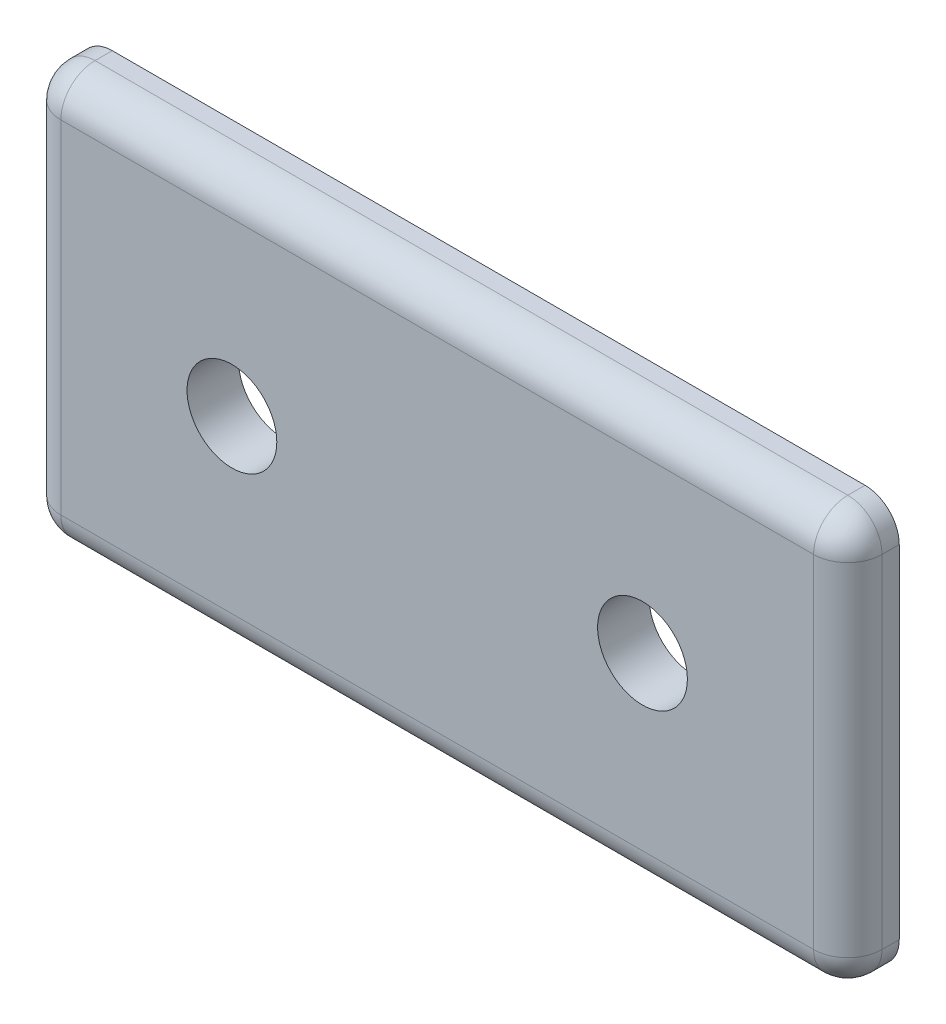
SolidWorks part; units mm, degrees
ref_plane "Front Plane" through (0, 0, 0) normal (0, 0, 1) x (1, 0, 0)
ref_plane "Top Plane" through (0, 0, 0) normal (0, 1, 0) x (1, 0, 0)
ref_plane "Right Plane" through (0, 0, 0) normal (1, 0, 0) x (0, 0, -1)
sketch "Sketch1" plane through (0, 0, 0) normal (0, 0, 1) x (1, 0, 0)
  line L0 (-38.1, 0) -> (38.1, 0) construction
  line L1 (-38.1, 19.05) -> (38.1, 19.05)
  line L2 (-38.1, 19.05) -> (-38.1, -19.05)
  line L3 (-38.1, -19.05) -> (38.1, -19.05)
  line L4 (38.1, 19.05) -> (38.1, -19.05)
  line L5 (0, 19.05) -> (0, -19.05) construction
  dimension "D1" = 38.1
  dimension "D2" = 76.2
extrude "Boss-Extrude1" add sketch "Sketch1" along normal blind 4.7752
fillet "Fillet1" radius 3.175 8 edges at (0, 19.05, 4.7752) (38.1, 0, 4.7752) (0, -19.05, 4.7752) (-38.1, 0, 4.7752) (-38.1, -19.05, 2.3876) (38.1, -19.05, 2.3876) (38.1, 19.05, 2.3876) (-38.1, 19.05, 2.3876)
sketch "Sketch2" plane through (0, 0, 4.7752) normal (0, 0, 1) x (1, 0, 0)
  line L1 (-19.05, 0) -> (19.05, 0) construction
  circle A0 centre (-19.05, 0) radius 4.1656
  circle A1 centre (19.05, 0) radius 4.1656
  dimension "D2" = 8.3312
  dimension "D1" = 38.1
extrude "Cut-Extrude1" cut sketch "Sketch2" against normal up to next
